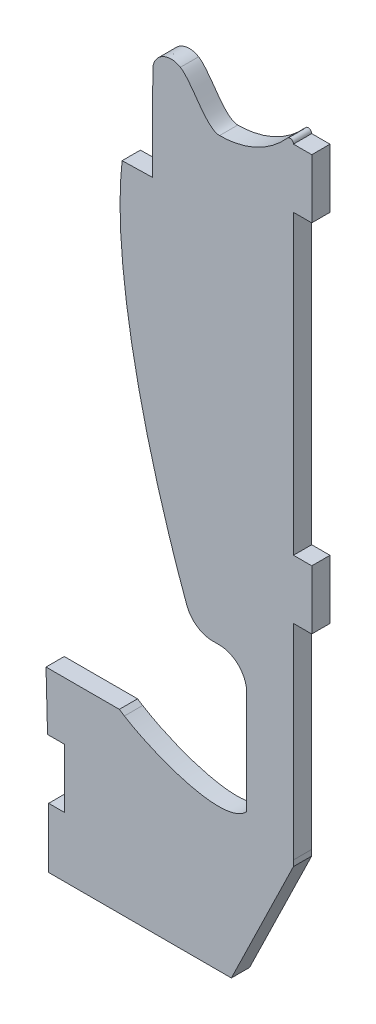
SolidWorks part; units mm, degrees
ref_plane "Alzado" through (0, 0, 0) normal (0, 0, 1) x (1, 0, 0)
ref_plane "Planta" through (0, 0, 0) normal (0, 1, 0) x (1, 0, 0)
ref_plane "Vista lateral" through (0, 0, 0) normal (1, 0, 0) x (0, 0, -1)
sketch "Croquis2" plane through (0, 0, 0) normal (0, 0, 1) x (1, 0, 0)
sketch_block_instance "F1 CAR CUT corte-1"
sketch_block "Bloque1"
extrude "Saliente-Extruir1" add sketch "Croquis2" along normal blind 3
delete or keep bodies "Sólido-Eliminar/Conservar 14" type delete bodies bodies 103 112 108 104 113 114
delete or keep bodies "Sólido-Eliminar/Conservar 15" type delete bodies bodies 101 102
delete or keep bodies "Sólido-Eliminar/Conservar 16" type delete bodies bodies 106
delete or keep bodies "Sólido-Eliminar/Conservar 17" type delete bodies bodies 107 109 110
delete or keep bodies "Sólido-Eliminar/Conservar 18" type delete bodies bodies 111
